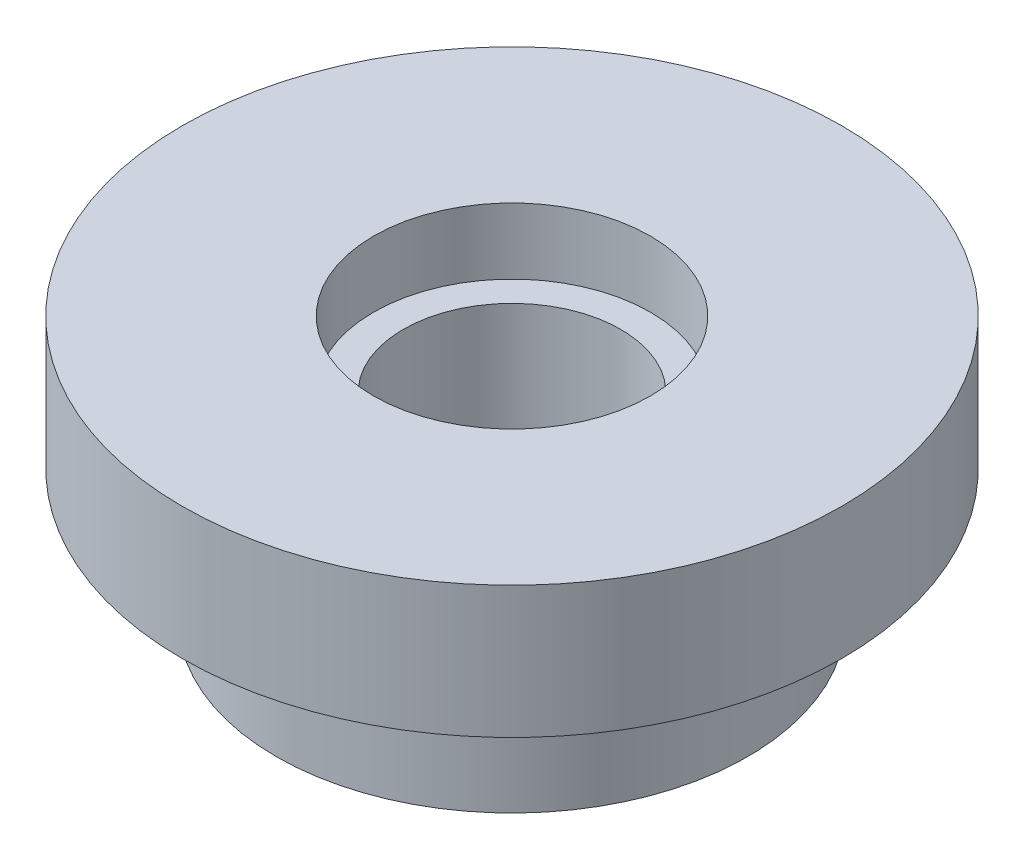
SolidWorks part; units mm, degrees
ref_plane "Front Plane" through (0, 0, 0) normal (0, 0, 1) x (1, 0, 0)
ref_plane "Top Plane" through (0, 0, 0) normal (0, 1, 0) x (1, 0, 0)
ref_plane "Right Plane" through (0, 0, 0) normal (1, 0, 0) x (0, 0, -1)
sketch "Sketch1" plane through (0, 0, 0) normal (0, 1, 0) x (1, 0, 0)
  circle A0 centre (0, 0) radius 50
  circle A1 centre (0, 0) radius 16.5
  dimension "D1" = 100
  dimension "D2" = 33
extrude "Extrude1" add sketch "Sketch1" along normal blind 40
sketch "Sketch2" plane through (0, 40, 0) normal (0, 1, 0) x (1, 0, 0)
  circle A0 centre (0, 0) radius 21
  dimension "D1" = 42
extrude "Extrude3" cut sketch "Sketch2" against normal blind 10
sketch "Sketch7" plane through (0, 0, 0) normal (0, -1, 0) x (1, 0, 0)
  circle A0 centre (0, 0) radius 35.75
  dimension "D1" = 71.5
extrude "Extrude4" cut sketch "Sketch7" against normal blind 20 flip side to cut
